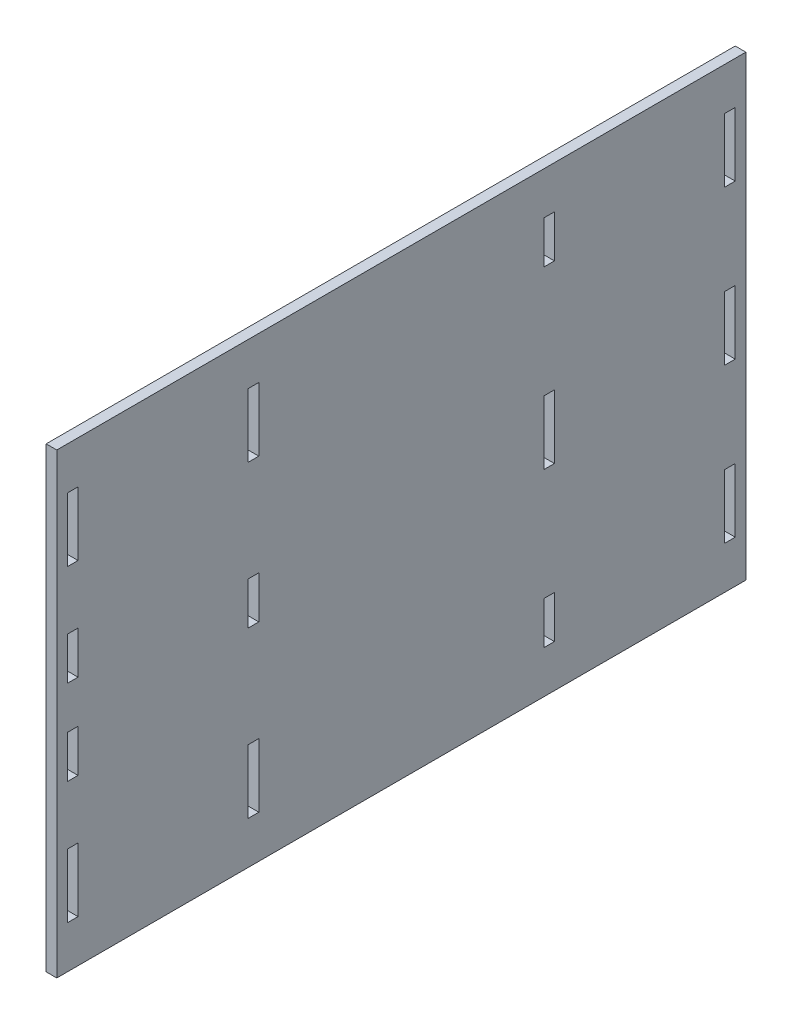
SolidWorks part; units mm, degrees
ref_plane "Front Plane" through (0, 0, 0) normal (0, 0, 1) x (1, 0, 0)
ref_plane "Top Plane" through (0, 0, 0) normal (0, 1, 0) x (1, 0, 0)
ref_plane "Right Plane" through (0, 0, 0) normal (1, 0, 0) x (0, 0, -1)
sketch "Sketch1" plane through (0, 0, 0) normal (1, 0, 0) x (0, 0, -1)
  line L1 (0, 0) -> (205.74, 0)
  line L2 (0, 0) -> (0, 136.525)
  line L3 (0, 136.525) -> (205.74, 136.525)
  line L4 (205.74, 0) -> (205.74, 136.525)
  dimension "D1" = 136.525
  dimension "D2" = 205.74
extrude "Boss-Extrude1" add sketch "Sketch1" along normal blind 3.175
sketch "Sketch2" plane through (3.175, 0, 0) normal (1, 0, 0) x (0, 0, -1)
  line L0 (0, 68.2625) -> (205.74, 68.2625) construction
  line L1 (0, 136.525) -> (0, 0) construction
  line L2 (205.74, 0) -> (205.74, 136.525) construction
  line L3 (205.74, 136.525) -> (0, 136.525) construction
  line L4 (3.175, 123.825) -> (6.35, 123.825)
  line L5 (3.175, 123.825) -> (3.175, 104.775)
  line L6 (3.175, 104.775) -> (6.35, 104.775)
  line L7 (6.35, 123.825) -> (6.35, 104.775)
  line L8 (4.7625, 74.6125) -> (4.7625, 61.9125) construction
  line L9 (3.175, 87.3125) -> (6.35, 87.3125)
  line L10 (3.175, 87.3125) -> (3.175, 74.6125)
  line L11 (3.175, 74.6125) -> (6.35, 74.6125)
  line L12 (6.35, 12.7) -> (6.35, 31.75)
  line L13 (3.175, 31.75) -> (6.35, 31.75)
  line L14 (3.175, 12.7) -> (3.175, 31.75)
  line L15 (3.175, 12.7) -> (6.35, 12.7)
  line L16 (60.325, 12.7) -> (60.325, 31.75)
  line L17 (57.15, 123.825) -> (60.325, 123.825)
  line L18 (57.15, 123.825) -> (57.15, 104.775)
  line L19 (57.15, 104.775) -> (60.325, 104.775)
  line L20 (60.325, 123.825) -> (60.325, 104.775)
  line L21 (57.15, 74.6125) -> (60.325, 74.6125)
  line L22 (57.15, 74.6125) -> (57.15, 61.9125)
  line L23 (57.15, 61.9125) -> (60.325, 61.9125)
  line L24 (60.325, 74.6125) -> (60.325, 61.9125)
  line L25 (57.15, 31.75) -> (60.325, 31.75)
  line L26 (57.15, 12.7) -> (57.15, 31.75)
  line L27 (57.15, 12.7) -> (60.325, 12.7)
  line L28 (148.59, 12.7) -> (148.59, 25.4)
  line L29 (145.415, 123.825) -> (148.59, 123.825)
  line L30 (145.415, 123.825) -> (145.415, 111.125)
  line L31 (145.415, 111.125) -> (148.59, 111.125)
  line L32 (148.59, 123.825) -> (148.59, 111.125)
  line L33 (145.415, 77.7875) -> (148.59, 77.7875)
  line L34 (145.415, 77.7875) -> (145.415, 58.7375)
  line L35 (145.415, 58.7375) -> (148.59, 58.7375)
  line L38 (148.59, 77.7875) -> (148.59, 58.7375)
  line L39 (145.415, 25.4) -> (148.59, 25.4)
  line L40 (145.415, 12.7) -> (145.415, 25.4)
  line L41 (145.415, 12.7) -> (148.59, 12.7)
  line L42 (202.565, 12.7) -> (202.565, 31.75)
  line L43 (199.39, 123.825) -> (202.565, 123.825)
  line L44 (199.39, 123.825) -> (199.39, 104.775)
  line L45 (199.39, 104.775) -> (202.565, 104.775)
  line L46 (202.565, 123.825) -> (202.565, 104.775)
  line L47 (199.39, 77.7875) -> (202.565, 77.7875)
  line L48 (199.39, 77.7875) -> (199.39, 58.7375)
  line L49 (199.39, 58.7375) -> (202.565, 58.7375)
  line L50 (202.565, 77.7875) -> (202.565, 58.7375)
  line L53 (199.39, 31.75) -> (202.565, 31.75)
  line L54 (199.39, 12.7) -> (199.39, 31.75)
  line L55 (199.39, 12.7) -> (202.565, 12.7)
  line L56 (6.35, 87.3125) -> (6.35, 74.6125)
  line L57 (3.175, 61.9125) -> (6.35, 61.9125)
  line L58 (3.175, 61.9125) -> (3.175, 49.2125)
  line L59 (3.175, 49.2125) -> (6.35, 49.2125)
  line L60 (6.35, 61.9125) -> (6.35, 49.2125)
  point P30 (57.15, 68.2625)
  point P42 (145.415, 68.2625)
  point P55 (199.39, 68.2625)
  point P65 (4.7625, 68.2625)
  dimension "D1" = 19.05
  dimension "D2" = 3.175
  dimension "D3" = 3.175
  dimension "D4" = 12.7
  dimension "D5" = 50.8
  dimension "D6" = 12.7
  dimension "D7" = 85.09
  dimension "D8" = 12.7
  dimension "D9" = 50.8
  dimension "D10" = 3.175
  dimension "D11" = 12.7
  dimension "D12" = 12.7
extrude "Cut-Extrude4" cut sketch "Sketch2" against normal through all
